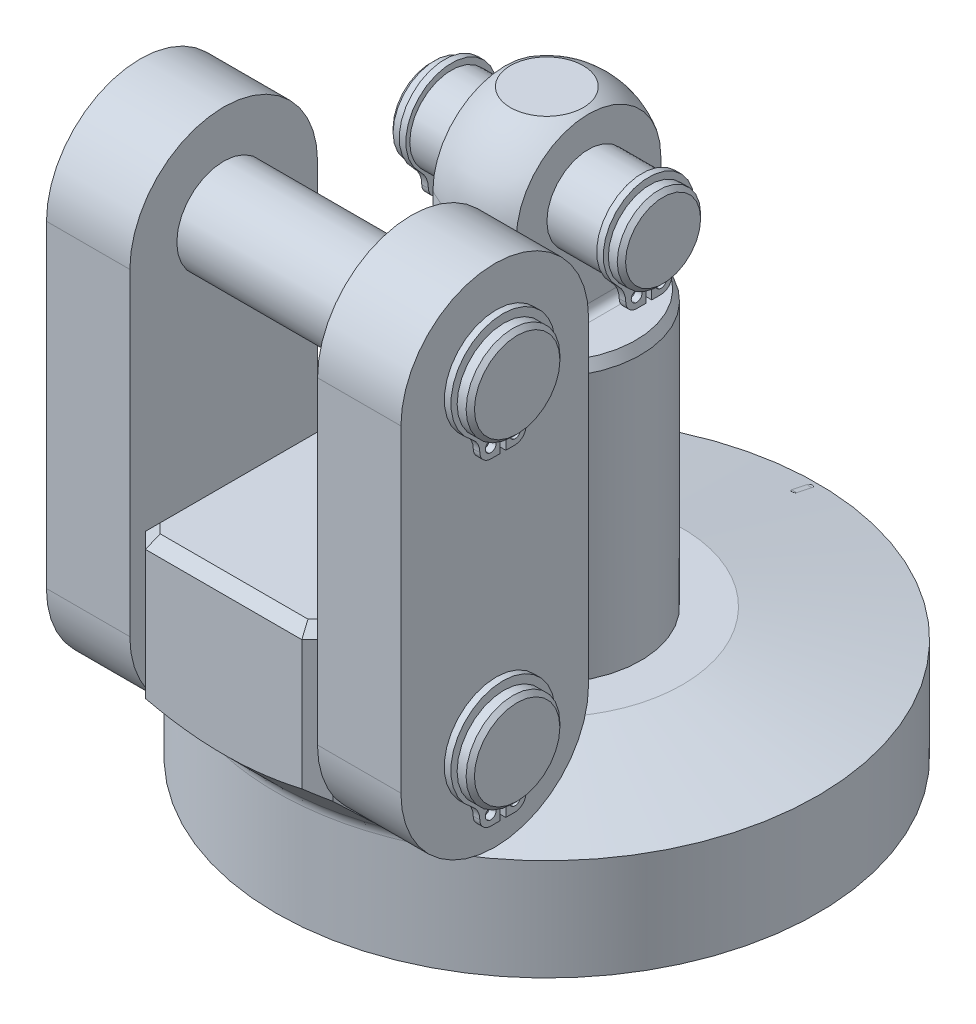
SolidWorks part; units mm, degrees
ref_plane "Front Plane" through (0, 0, 0) normal (0, 0, 1) x (1, 0, 0)
ref_plane "Top Plane" through (0, 0, 0) normal (0, 1, 0) x (1, 0, 0)
ref_plane "Right Plane" through (0, 0, 0) normal (1, 0, 0) x (0, 0, -1)
sketch "Sketch1" plane through (0, 0, 0) normal (0, 1, 0) x (1, 0, 0)
  line L0 (-9, 0) -> (9, 0)
  line L1 (9, 0) -> (9, -31)
  line L2 (9, -31) -> (-9, -31)
  line L3 (-9, -31) -> (-9, 0)
  line L4 (0, 1.05) -> (0, -22.05) construction
  dimension "D1" = 18
  dimension "D2" = 31
extrude "Extrude1" add sketch "Sketch1" along normal blind 30
sketch "S2D0003" plane through (0, 0, 0) normal (1, 0, 0) x (0, 0, -1)
  line L0 (0, 0) -> (0, 12.5)
  line L1 (-31, 0) -> (0, 0)
  line L2 (-31, 0) -> (-31, 8.674)
  line L3 (0, 12.5) -> (-13, 12.5)
  line L4 (-13, 12.5) -> (-31, 8.674)
  line L5 (0, 9.45) -> (0, -2.5987) construction
  line L6 (0, 30) -> (0, 0) construction
  line L8 (-31, 0) -> (0, 0) construction
  line L10 (-31, 30) -> (-31, 0) construction
  dimension "D1" = 12.5
  dimension "D2" = 12
  dimension "D3" = 26
sketch "S2D0004" plane through (0, 0, 0) normal (1, 0, 0) x (0, 0, -1)
  line L0 (-36, 20.7157) -> (-26.4039, 11.1197)
  line L1 (-25.965, 10.06) -> (-25.965, 0)
  line L2 (0, 16.6313) -> (0, -1.1122) construction
  line L3 (0, 30) -> (0, 0) construction
  line L5 (-31, 0) -> (0, 0) construction
  line L6 (-36, 20.7157) -> (-36, 0)
  line L7 (-36, 0) -> (-25.965, 0)
  line L8 (-31, 30) -> (-31, 0) construction
  arc A0 (-25.965, 10.06) -> (-26.4039, 11.1197) centre (-27.4636, 10.06) ccw
  dimension "D4" = 1.4986
  dimension "D1" = 51.93
  dimension "D2" = 10.06
  dimension "D3" = 45
  dimension "D5" = 5
sketch "Sketch4" plane through (0, 0, 0) normal (1, 0, 0) x (0, 0, -1)
  line L0 (0, 12.5) -> (13, 12.5)
  line L1 (13, 12.5) -> (13, 30)
  line L2 (13, 30) -> (0, 30)
  line L3 (0, 30) -> (0, 12.5)
  line L4 (0, 21.6) -> (0, 8.4) construction
  line L5 (0, 30) -> (0, 0) construction
  line L6 (-31, 30) -> (0, 30) construction
  dimension "D1" = 26
  dimension "D2" = 17.5
revolve "Cut-Revolve5" cut sketch "Sketch4" angle 360 about L4
revolve "Revolve1" add sketch "S2D0003" angle 360 about L5
revolve "Cut-Revolve4" cut sketch "S2D0004" angle 360 about L2
sketch "Sketch7" plane through (9, 0, 0) normal (1, 0, 0) x (0, 0, -1)
  line L0 (-25.965, 0) -> (25.965, 0) construction
  circle A0 centre (-22, 21) radius 4.5
  dimension "D1" = 9
  dimension "D2" = 21
  dimension "D3" = 22
extrude "Cut-Extrude3" cut sketch "Sketch7" against normal through all
fillet "Fillet1" radius 2.0066 2 edges at (-9, 21.25, 9.3808) (9, 21.25, 9.3808)
fillet "Fillet2" radius 3.18 5 edges at (-8.0259, 12.2725, 11.5568) (0, 12.5, 13) (7.9617, 12.2867, 11.5199)
chamfer "Chamfer1" distance 1.5 angle 45 2 edges at (-9, 23.4979, 31) (9, 23.4979, 31)
chamfer "Chamfer2" distance 1 angle 45 8 edges at (-9, 30, 21.3887) (-8.0302, 30, 11.5595) (0, 30, 13) (8.0302, 30, 11.5595) (-8.25, 30, 30.25) (9, 30, 21.3887) (8.25, 30, 30.25) (0, 30, 31)
ref_plane "Plane1" through (0, 0, 22) normal (0, 0, 1) x (1, 0, 0)
sketch "Sketch8" plane through (0, 0, 22) normal (0, 0, 1) x (1, 0, 0)
  line L0 (9, 21) -> (9, 11.5)
  line L1 (10.14, 10.36) -> (19.64, 10.36)
  line L2 (19.64, 10.36) -> (19.64, 21)
  line L3 (19.64, 21) -> (9, 21)
  line L4 (5.637, 21) -> (19.4125, 21) construction
  line L5 (-9, 21) -> (9, 21) construction
  line L6 (9, 30) -> (9, 16.9958) construction
  line L7 (0, 0) -> (0, 26.6501) construction
  line L8 (-19.64, 21) -> (-9, 21)
  line L9 (-19.64, 10.36) -> (-19.64, 21)
  line L10 (-10.14, 10.36) -> (-19.64, 10.36)
  line L11 (-9, 21) -> (-9, 11.5)
  arc A0 (9, 11.5) -> (10.14, 10.36) centre (10.14, 11.5) ccw
  arc A1 (-9, 11.5) -> (-10.14, 10.36) centre (-10.14, 11.5) cw
  dimension "D4" = 1.14
  dimension "D2" = 21.28
  dimension "D3" = 10.64
revolve "Cut-Revolve6" cut sketch "Sketch8" angle 360 about L4
sketch "Sketch10" plane through (0, 0, 0) normal (1, 0, 0) x (0, 0, -1)
  line L0 (0, 12.5) -> (0, 55.6918)
  line L1 (0, 55.6918) -> (3.4894, 55.6918)
  line L2 (8.001, 48.4918) -> (8.001, 40.0507)
  line L3 (8.001, 40.0507) -> (9.0043, 37.8991)
  line L4 (9.0043, 37.8991) -> (9.0043, 12.5)
  line L5 (9.0043, 12.5) -> (0, 12.5)
  line L6 (0, 44.745) -> (0, 7.55) construction
  line L7 (22.759, -21.0026) -> (-24.5324, -21.0026) construction
  line L9 (13, 12.5) -> (-8.7114, 12.5) construction
  arc A0 (8.001, 48.4918) -> (3.4894, 55.6918) centre (0, 48.4918) ccw
  circle A1 centre (0, 48.4918) radius 4 construction
  dimension "D2" = 8.001
  dimension "D3" = 8
  dimension "D5" = 69.4944
  dimension "D1" = 7.2
  dimension "D4" = 33.5026
  dimension "D6" = 18.0086
  dimension "D7" = 16.002
  dimension "D8" = 25
  dimension "D9" = 17.7927
  dimension "D10" = 25.3991
  dimension "D11" = 43.1918
revolve "Revolve2" add sketch "Sketch10" angle 360 about L6
sketch "Sketch12" plane through (0, 0, 0) normal (0, 0, 1) x (1, 0, 0)
  line L0 (4, 55.6918) -> (9.0043, 55.6918)
  line L1 (9.0043, 55.6918) -> (9.0043, 38.8918)
  line L2 (9.0043, 38.8918) -> (4.8, 38.8918)
  line L3 (4, 39.6918) -> (4, 55.6918)
  line L4 (3.4894, 55.6918) -> (-3.4894, 55.6918) construction
  line L5 (9.0043, 12.5) -> (9.0043, 37.8991) construction
  line L6 (-4, 39.6918) -> (-4, 55.6918)
  line L7 (-9.0043, 38.8918) -> (-4.8, 38.8918)
  line L8 (0, 38.525) -> (0, 26.975) construction
  line L9 (-9.0043, 55.6918) -> (-9.0043, 38.8918)
  line L10 (-4, 55.6918) -> (-9.0043, 55.6918)
  arc A0 (4, 39.6918) -> (4.8, 38.8918) centre (4.8, 39.6918) ccw
  arc A1 (-4, 39.6918) -> (-4.8, 38.8918) centre (-4.8, 39.6918) cw
  dimension "D3" = 0.8
  dimension "D1" = 8
  dimension "D2" = 16.8
extrude "Cut-Extrude5" cut sketch "Sketch12" against normal mid plane 16
sketch "Sketch14" plane through (4, 0, 0) normal (1, 0, 0) x (0, 0, -1)
  line L0 (3.4894, 55.6918) -> (-3.4894, 55.6918) construction
  circle A0 centre (0, 48.4918) radius 4
  dimension "D2" = 8
  dimension "D1" = 7.2
extrude "Cut-Extrude7" cut sketch "Sketch14" against normal up to next
sketch "S2D0005" plane through (9, 0, 0) normal (1, 0, 0) x (0, 0, -1)
  line L0 (-30.9949, 51.5015) -> (-31, 21.0015)
  line L1 (-12.9949, 51.4985) -> (-13, 20.9985)
  line L2 (-21.9949, 51.5) -> (-22, 21) construction
  line L3 (0, 48.4918) -> (0.0015, 51.489) construction
  line L4 (0.0015, 51.489) -> (-21.9949, 51.5) construction
  arc A0 (-12.9949, 51.4985) -> (-30.9949, 51.5015) centre (-21.9949, 51.5) ccw
  arc A1 (-31, 21.0015) -> (-13, 20.9985) centre (-22, 21) ccw
  circle A2 centre (-21.9949, 51.5) radius 4.5
  circle A3 centre (-22, 21) radius 4.5
  circle A6 centre (-22, 21) radius 4.5 construction
  dimension "D2" = 30.5
  dimension "D1" = 18
  dimension "D3" = 21.9964
  dimension "D4" = 2.9972
extrude "Extrude2" add sketch "S2D0005" along normal blind 8
sketch "S2D0006" plane through (0, 0, 0) normal (0, 0, 1) x (1, 0, 0)
  line L0 (-9.15, 52.4918) -> (9.15, 52.4918)
  line L1 (11.15, 52.0918) -> (11.15, 48.4918)
  line L2 (10.75, 52.4918) -> (11.15, 52.0918)
  line L3 (9.89, 52.4918) -> (10.75, 52.4918)
  line L4 (9.89, 52.1768) -> (9.89, 52.4918)
  line L5 (9.15, 52.1768) -> (9.89, 52.1768)
  line L6 (9.15, 52.4918) -> (9.15, 52.1768)
  line L7 (11.15, 48.4918) -> (-11.15, 48.4918)
  line L8 (-9.15, 52.4918) -> (-9.15, 52.1768)
  line L9 (-9.15, 52.1768) -> (-9.89, 52.1768)
  line L10 (-9.89, 52.1768) -> (-9.89, 52.4918)
  line L11 (-9.89, 52.4918) -> (-10.75, 52.4918)
  line L12 (-10.75, 52.4918) -> (-11.15, 52.0918)
  line L13 (-11.15, 52.0918) -> (-11.15, 48.4918)
  line L14 (-8.415, 48.4918) -> (8.415, 48.4918) construction
  line L15 (-4, 48.4918) -> (4, 48.4918) construction
  line L16 (0, 40.8686) -> (0, 24.9357) construction
  line L17 (0, 40.0507) -> (0, 48.4918) construction
  line L18 (4, 52.4918) -> (-4, 52.4918) construction
  dimension "D1" = 22.3
  dimension "D3" = 0.74
  dimension "D4" = 7.37
  dimension "D5" = 18.3
  dimension "D6" = 0.4
  dimension "D7" = 45
revolve "Revolve3" add sketch "S2D0006" angle 360 about L14
ref_plane "Plane2" through (0, 0, 22) normal (0, 0, 1) x (1, 0, 0)
sketch "Sketch18" plane through (0, 0, 22) normal (0, 0, 1) x (1, 0, 0)
  line L0 (-17.15, 25.5) -> (17.15, 25.5)
  line L1 (19.15, 25.1) -> (19.15, 21)
  line L2 (18.75, 25.5) -> (19.15, 25.1)
  line L3 (17.89, 25.5) -> (18.75, 25.5)
  line L4 (17.89, 25.19) -> (17.89, 25.5)
  line L5 (17.15, 25.19) -> (17.89, 25.19)
  line L6 (17.15, 25.5) -> (17.15, 25.19)
  line L7 (-17.15, 25.5) -> (-17.15, 25.19)
  line L8 (-17.15, 25.19) -> (-17.89, 25.19)
  line L9 (-17.89, 25.19) -> (-17.89, 25.5)
  line L10 (-17.89, 25.5) -> (-18.75, 25.5)
  line L11 (-18.75, 25.5) -> (-19.15, 25.1)
  line L12 (-19.15, 25.1) -> (-19.15, 21)
  line L13 (-13.915, 21) -> (13.915, 21) construction
  line L14 (-9, 21) -> (17, 21) construction
  line L15 (0, 28.7058) -> (0, -18.8155) construction
  line L16 (-19.15, 21) -> (19.15, 21)
  line L17 (17, 25.5) -> (-9, 25.5) construction
  dimension "D2" = 38.3
  dimension "D3" = 8.38
  dimension "D4" = 0.74
  dimension "D5" = 34.3
  dimension "D6" = 0.4
  dimension "D7" = 45
revolve "Revolve4" add sketch "Sketch18" angle 360 about L13
sketch "Sketch20" plane through (9.15, 0, 0) normal (1, 0, 0) x (0, 0, -1)
  line L0 (0.2762, 42.724) -> (1.169, 42.724)
  line L1 (0.2762, 44.934) -> (0.2762, 42.724)
  line L2 (-0.2763, 44.934) -> (-0.2763, 42.724)
  line L3 (-0.2763, 42.724) -> (-1.169, 42.724)
  line L4 (0, 30.527) -> (0, 23.2449) construction
  arc A0 (0.2762, 44.934) -> (-0.2763, 44.934) centre (0, 48.4918) ccw
  arc A1 (2.9608, 45.4734) -> (-2.9608, 45.4734) centre (0, 48.6984) ccw
  circle A2 centre (0, 48.4918) radius 4 construction
  circle A3 centre (1.169, 43.765) radius 0.5205
  arc A4 (2.21, 43.765) -> (1.169, 42.724) centre (1.169, 43.765) cw
  arc A5 (-2.21, 43.765) -> (-2.9608, 45.4734) centre (-4.5292, 43.765) ccw
  arc A6 (-2.21, 43.765) -> (-1.169, 42.724) centre (-1.169, 43.765) ccw
  circle A7 centre (-1.169, 43.765) radius 0.5205
  arc A8 (2.21, 43.765) -> (2.9608, 45.4734) centre (4.5292, 43.765) cw
  dimension "D1" = 0.5525
  dimension "D2" = 3.5685
  dimension "D3" = 4.3779
  dimension "D4" = 0.2066
  dimension "D6" = 1.041
  dimension "D9" = 1.041
  dimension "D10" = 2.3192
  dimension "D7" = 2.338
  dimension "D8" = 4.7268
extrude "Extrude4" add sketch "Sketch20" along normal blind 0.635
sketch "Sketch21" plane through (17.15, 0, 0) normal (1, 0, 0) x (0, 0, -1)
  line L0 (-21.7248, 14.7352) -> (-20.832, 14.735)
  line L1 (-21.7244, 16.9454) -> (-21.7248, 14.7352)
  line L2 (-22.2769, 16.9454) -> (-22.2773, 14.7353)
  line L3 (-22.2773, 14.7353) -> (-23.17, 14.7354)
  line L4 (-22.0024, 6.7838) -> (-22.0035, 0.3066) construction
  line L5 (-30.9949, 51.5015) -> (-31, 21.0015) construction
  arc A0 (-21.7244, 16.9454) -> (-22.2769, 16.9454) centre (-22, 21) ccw
  arc A1 (-19.0647, 17.2013) -> (-24.9366, 17.2023) centre (-22, 21.2396) ccw
  circle A2 centre (-20.8319, 15.776) radius 0.5205
  arc A3 (-19.7909, 15.7759) -> (-20.832, 14.735) centre (-20.8319, 15.776) cw
  arc A4 (-19.7909, 15.7759) -> (-19.0647, 17.2013) centre (-18.0285, 15.7757) cw
  arc A5 (-24.2109, 15.7766) -> (-24.9366, 17.2023) centre (-25.9733, 15.7771) ccw
  arc A6 (-24.2109, 15.7766) -> (-23.17, 14.7354) centre (-23.1699, 15.7764) ccw
  circle A7 centre (-23.1699, 15.7764) radius 0.5205
  circle A8 centre (-22, 21) radius 4.5 construction
  dimension "D1" = 4.064
  dimension "D2" = 4.9924
  dimension "D3" = 0.2396
  dimension "D7" = 1.041
  dimension "D8" = 1.041
  dimension "D9" = 5.2236
  dimension "D10" = 1.7624
  dimension "D4" = 0.5525
  dimension "D6" = 2.338
extrude "Extrude5" add sketch "Sketch21" along normal blind 0.635
pattern_linear "LPattern1" count 2 spacing 30.5 along (0, 1, -0.0002) of "Extrude5", "Revolve4"
mirror "Mirror1" about plane through (0, 0, 0) normal (1, 0, 0) of "Extrude5", "LPattern1", "Extrude4", "Extrude2"
sketch "Sketch22" plane through (0, 0, 0) normal (1, 0, 0) x (0, 0, -1)
  line L0 (24.2755, 10.8803) -> (26.0312, 10.5071) construction
  line L1 (25.965, 9.7442) -> (13, 12.5) construction
  line L2 (23.5196, 10.264) -> (25.4759, 9.8482) construction
  line L3 (23.922, 10.9554) -> (25.3896, 10.6435) construction
  line L5 (23.7557, 10.1729) -> (25.2233, 9.861)
  line L8 (23.1395, 11.1218) -> (26.1721, 10.4772)
  arc A0 (23.1395, 11.1218) -> (23.7557, 10.1729) centre (23.922, 10.9554) ccw
  arc A1 (25.2233, 9.861) -> (26.1721, 10.4772) centre (25.3896, 10.6435) ccw
  dimension "D1" = 1.6
  dimension "D2" = 0.76
  dimension "D3" = 2
  dimension "D4" = 0.5
revolve "Cut-Revolve7" cut sketch "Sketch22" angle 360 about L8
